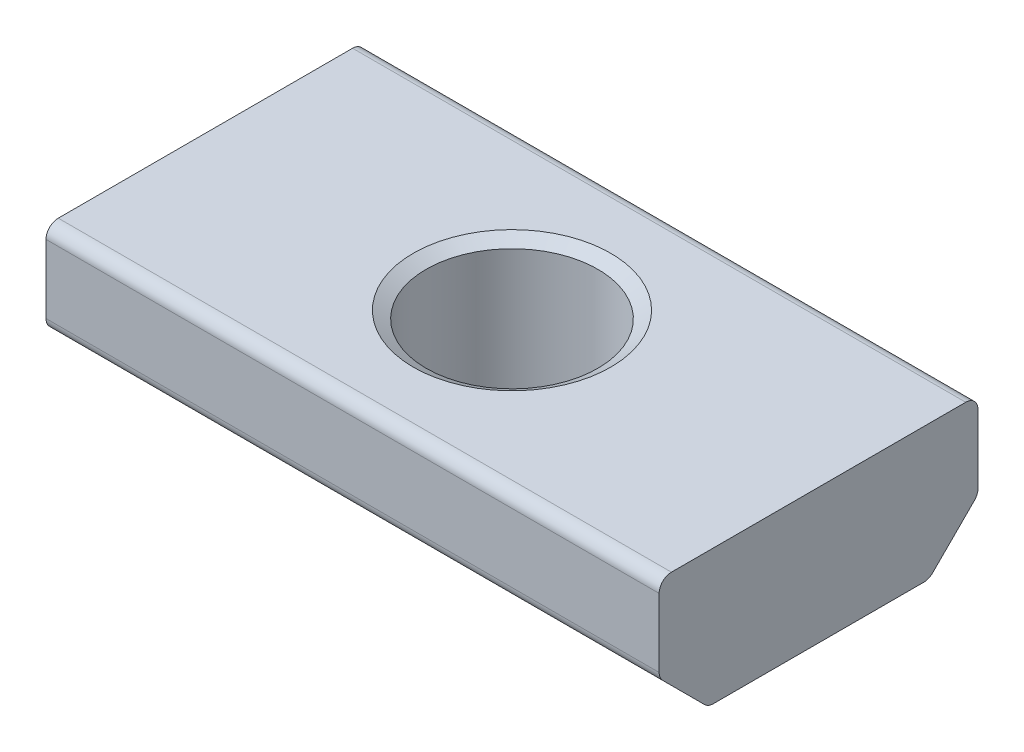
SolidWorks part; units mm, degrees
ref_plane "Front Plane" through (0, 0, 0) normal (0, 0, 1) x (1, 0, 0)
ref_plane "Top Plane" through (0, 0, 0) normal (0, 1, 0) x (1, 0, 0)
ref_plane "Right Plane" through (0, 0, 0) normal (1, 0, 0) x (0, 0, -1)
sketch "Sketch1" plane through (0, 0, 0) normal (0, 1, 0) x (1, 0, 0)
  line L1 (0, 0) -> (25, 0)
  line L2 (0, 0) -> (0, 13)
  line L3 (0, 13) -> (25, 13)
  line L4 (25, 0) -> (25, 13)
  dimension "D1" = 25
  dimension "D2" = 13
extrude "Boss-Extrude1" add sketch "Sketch1" along normal blind 5.5
chamfer "Chamfer1" distance 2 angle 45 2 edges at (12.5, 0, -13) (12.5, 0, 0)
fillet "Fillet1" radius 0.5 6 edges at (12.5, 2, 0) (12.5, 0, -2) (12.5, 0, -11) (12.5, 2, -13) (12.5, 5.5, -13) (12.5, 5.5, 0)
hole_wizard "M8x1.0 Tapped Hole1" positions "Sketch2" profile "Sketch3" tap size "M8x1.0" standard "ANSI Metric"
sketch "Sketch2" plane through (0, 5.5, 0) normal (0, 1, 0) x (1, 0, 0)
  point P0 (12.5, 6.5)
sketch "Sketch3" plane through (12.5, 5.5, -6.5) normal (1, 0, 0) x (0, 0, 1)
  line L0 (0, 0) -> (0, 5.5)
  line L1 (0, 5.5) -> (3.5, 5.5)
  line L2 (3.5, 5.5) -> (3.5, 0.3031)
  line L3 (3.5, 0.3031) -> (4.025, 0)
  line L5 (4.025, 0) -> (0, 0)
  line L6 (-3.5, 0.3031) -> (-4.025, 0) construction
  line L11 (0, -6.35) -> (0, 107.95) construction
  dimension "Thru Tap Drill Dia." = 7
  dimension "Thru Tap Drill Depth" = 5.5
  dimension "Near C'Sink Dia." = 8.05
  dimension "Near C'Sink Angle" = 120
